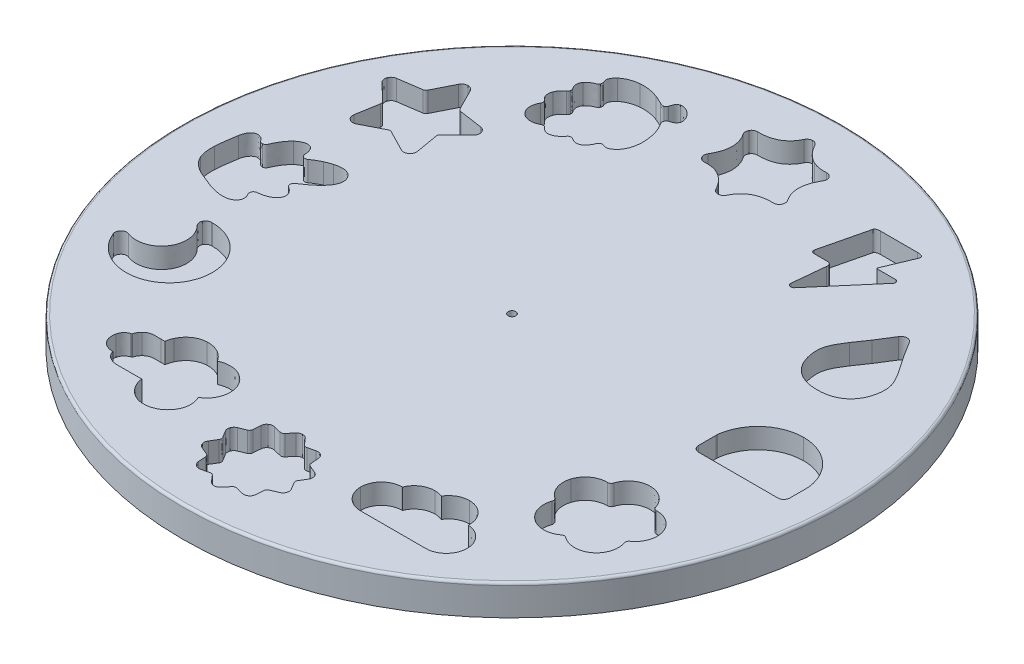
SolidWorks part; units mm, degrees
ref_plane "Front Plane" through (0, 0, 0) normal (0, 0, 1) x (1, 0, 0)
ref_plane "Top Plane" through (0, 0, 0) normal (0, 1, 0) x (1, 0, 0)
ref_plane "Right Plane" through (0, 0, 0) normal (1, 0, 0) x (0, 0, -1)
body saved out of another part "Stock-Wooden Clock Video-1"
fillet "Fillet1" radius 1 1 edges at (0, 12, 130)
